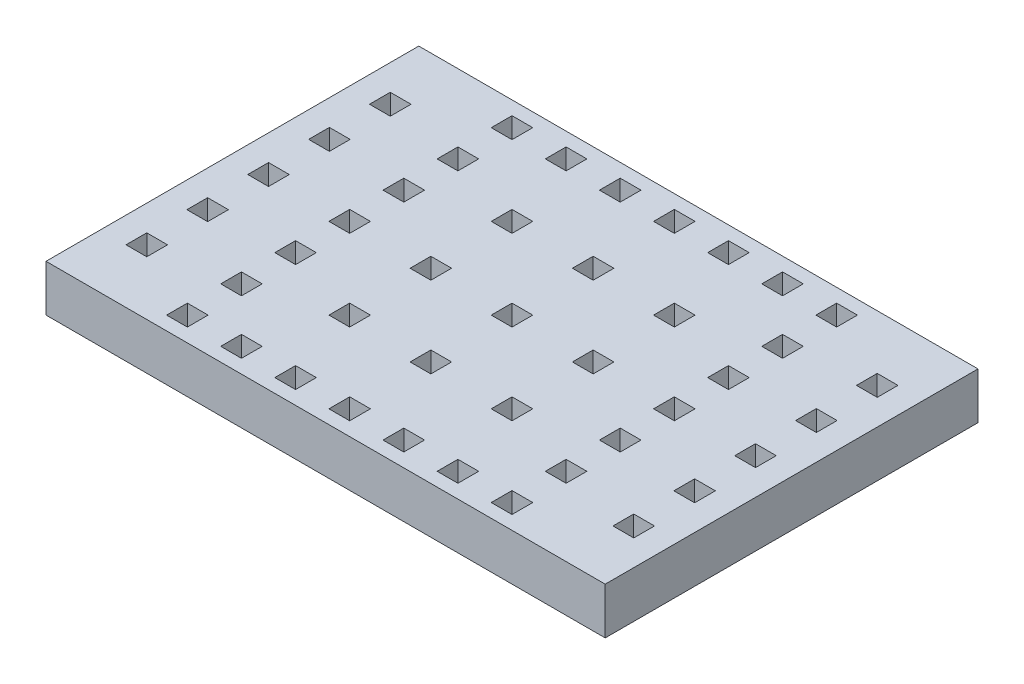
SolidWorks part; units mm, degrees
ref_plane "Front Plane" through (0, 0, 0) normal (0, 0, 1) x (1, 0, 0)
ref_plane "Top Plane" through (0, 0, 0) normal (0, 1, 0) x (1, 0, 0)
ref_plane "Right Plane" through (0, 0, 0) normal (1, 0, 0) x (0, 0, -1)
sketch "Sketch1" plane through (0, 0, 0) normal (0, 1, 0) x (1, 0, 0)
  line L1 (-76.2, 50.8) -> (76.2, 50.8)
  line L2 (-76.2, 50.8) -> (-76.2, -50.8)
  line L3 (-76.2, -50.8) -> (76.2, -50.8)
  line L4 (76.2, 50.8) -> (76.2, -50.8)
  dimension "D1" = 152.4
  dimension "D2" = 76.2
  dimension "D3" = 101.6
  dimension "D4" = 50.8
extrude "Extrude1" add sketch "Sketch1" along normal blind 12.7
other "Fill Pattern3" parameters "D8"=5.6569, "D4"=22.1188, "D5"=15.24, "D3"=0
